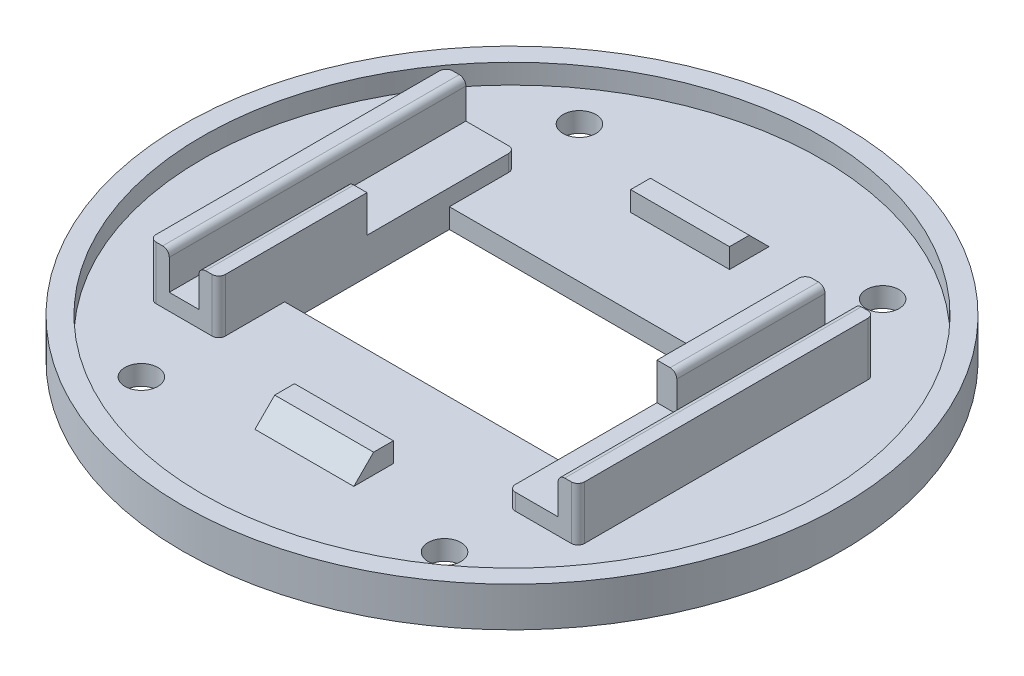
SolidWorks part; units mm, degrees
other "<a_base>-<Supports>"
ref_plane "Front Plane" through (0, 0, 0) normal (0, 0, 1) x (1, 0, 0)
ref_plane "Top Plane" through (0, 0, 0) normal (0, 1, 0) x (1, 0, 0)
ref_plane "Right Plane" through (0, 0, 0) normal (1, 0, 0) x (0, 0, -1)
inserted part "a_base"
sketch "Sketch1" plane through (0, 3, 0) normal (0, 1, 0) x (1, 0, 0)
  circle A0 centre (0, 0) radius 50 construction
  circle A1 centre (0, 0) radius 50
  circle A2 centre (0, 0) radius 47
  dimension "D1" = 3
extrude "Base Wall" add sketch "Sketch1" along normal blind 3
sketch "Sketch2" plane through (0, 3, 0) normal (0, 1, 0) x (1, 0, 0)
  line L0 (0, 47) -> (0, -47) construction
  line L1 (-47, 0) -> (47, 0) construction
  line L2 (7.5, -28.5) -> (7.5, -25.5)
  line L3 (-7.5, 28.5) -> (7.5, 28.5)
  line L4 (-7.5, 28.5) -> (-7.5, 25.5)
  line L5 (-7.5, 25.5) -> (7.5, 25.5)
  line L6 (7.5, 28.5) -> (7.5, 25.5)
  line L7 (-7.5, -25.5) -> (7.5, -25.5)
  line L8 (-7.5, -28.5) -> (-7.5, -25.5)
  line L9 (-7.5, -28.5) -> (7.5, -28.5)
  circle A0 centre (0, 0) radius 47 construction
  dimension "D1" = 15
  dimension "D2" = 3
  dimension "D3" = 25.5
extrude "Base Support" add sketch "Sketch2" along normal blind 3
chamfer "Base Support Chamfer" distance 3 2 edges at (0, 3, -28.5) (0, 3, 28.5)
sketch "Sketch3" plane through (0, 3, 0) normal (0, 1, 0) x (1, 0, 0)
  line L0 (0, 47) -> (0, -47) construction
  line L1 (0, 0) -> (-47, 0) construction
  line L2 (-32.5, 22.5) -> (-22, 22.5)
  line L3 (-32.5, 22.5) -> (-32.5, -22.5)
  line L4 (-32.5, -22.5) -> (-22, -22.5)
  line L5 (-22, 22.5) -> (-22, -22.5)
  line L6 (32.5, -22.5) -> (22, -22.5)
  line L7 (22, 22.5) -> (22, -22.5)
  line L8 (32.5, 22.5) -> (32.5, -22.5)
  line L9 (32.5, 22.5) -> (22, 22.5)
  circle A0 centre (0, 0) radius 47 construction
  dimension "D1" = 10.5
  dimension "D2" = 45
  dimension "D3" = 22
extrude "Side Support" add sketch "Sketch3" along normal blind 2.5
sketch "Sketch4" plane through (0, 5.5, 0) normal (0, 1, 0) x (1, 0, 0)
  line L0 (-32.5, -22.5) -> (-22, -22.5) construction
  line L1 (-32.5, 22.5) -> (-29.5, 22.5)
  line L2 (-32.5, 22.5) -> (-32.5, -22.5)
  line L3 (-32.5, -22.5) -> (-29.5, -22.5)
  line L4 (-29.5, 22.5) -> (-29.5, -22.5)
  line L5 (-22, -22.5) -> (-22, 22.5) construction
  line L6 (-22, 0) -> (-25, 0)
  line L7 (-22, 0) -> (-22, -22.5)
  line L8 (-22, -22.5) -> (-25, -22.5)
  line L9 (-25, 0) -> (-25, -22.5)
  line L10 (22, 22.5) -> (22, -22.5) construction
  line L11 (22, 0) -> (25, 0)
  line L12 (22, 0) -> (22, 22.5)
  line L13 (22, 22.5) -> (25, 22.5)
  line L14 (25, 0) -> (25, 22.5)
  line L15 (32.5, 22.5) -> (22, 22.5) construction
  line L17 (32.5, -22.5) -> (29.5, -22.5)
  line L18 (32.5, -22.5) -> (32.5, 22.5)
  line L19 (32.5, 22.5) -> (29.5, 22.5)
  line L20 (29.5, -22.5) -> (29.5, 22.5)
  dimension "D1" = 3
extrude "Side Support Walls" add sketch "Sketch4" along normal blind 5.6
sketch "Sketch5" plane through (0, 3, 0) normal (0, 1, 0) x (1, 0, 0)
  line L0 (-22, 0) -> (22, 0) construction
  line L1 (-22, -22.5) -> (-22, 22.5) construction
  line L2 (22, 22.5) -> (22, -22.5) construction
  line L4 (-22, 12.5) -> (22, 12.5)
  line L5 (-22, 12.5) -> (-22, -12.5)
  line L6 (-22, -12.5) -> (22, -12.5)
  line L7 (22, 12.5) -> (22, -12.5)
  dimension "D1" = 25
extrude "Connector Clearance" cut sketch "Sketch5" against normal through all
fillet "Contouring" radius 1 12 edges at (32.5, 7.05, -22.5) (22, 7.05, -22.5) (25, 11.1, -11.25) (29.5, 11.1, 0) (32.5, 7.05, 22.5) (22, 4.25, 22.5) (-32.5, 7.05, -22.5) (-22, 4.25, -22.5) (-32.5, 7.05, 22.5) (-22, 7.05, 22.5) (-25, 11.1, 11.25) (-29.5, 11.1, 0)
ref_point "Ref Center"
equation "\"D1@Sketch1\" = \"width keep@values@params_print.sldprt\""
equation "\"D1@Base Wall\" = \"width keep@values@params_print.sldprt\""
equation "\"D2@Sketch2\" = \"width keep@values@params_print.sldprt\""
equation "\"D1@Base Support\" = \"width keep@values@params_print.sldprt\""
equation "\"D1@Base Support Chamfer\" = \"width keep@values@params_print.sldprt\""
equation "\"D1@Sketch3\" = 4.5 + 2 * \"width keep@values@params_print.sldprt\""
equation "\"D3@Sketch3\" = 25 - \"width keep@values@params_print.sldprt\""
equation "\"D1@Sketch4\" = \"width keep@values@params_print.sldprt\""
